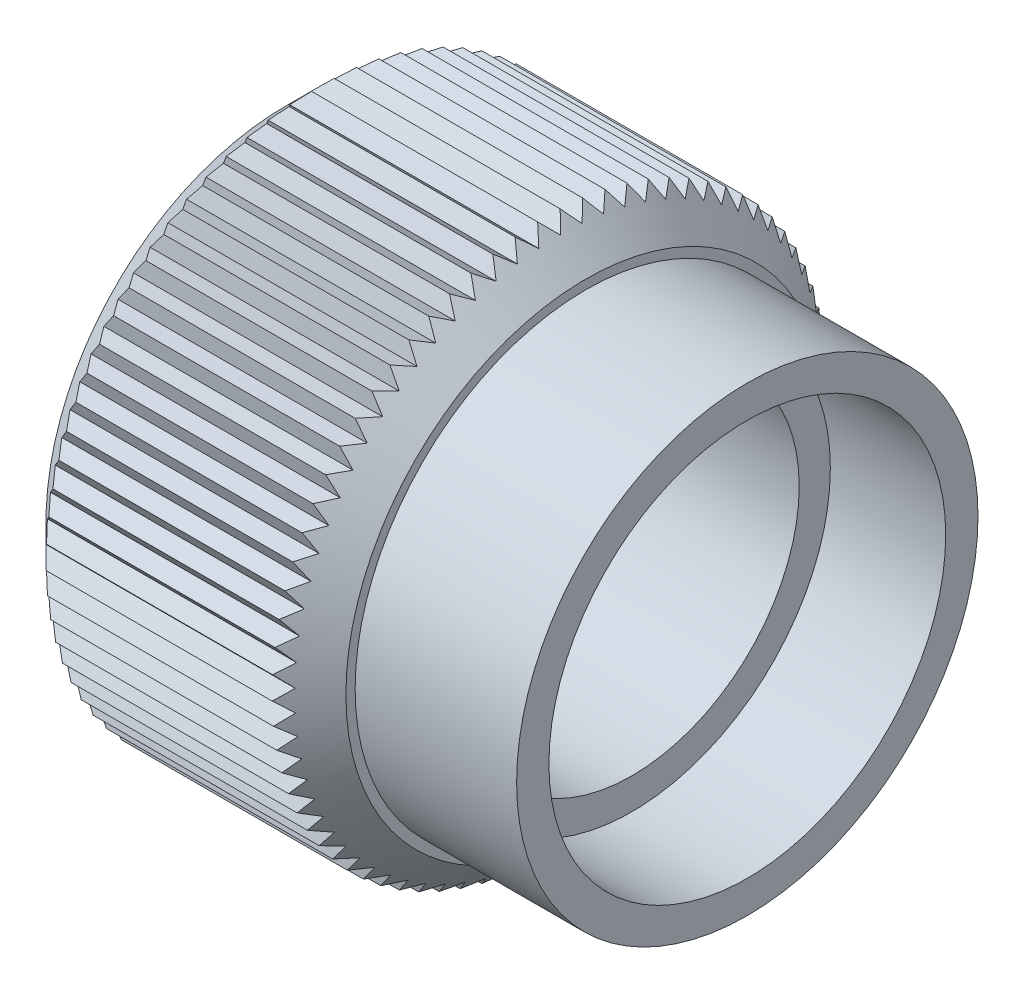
SolidWorks part; units mm, degrees
ref_plane "Vorne" through (0, 0, 0) normal (0, 0, 1) x (1, 0, 0)
ref_plane "Oben" through (0, 0, 0) normal (0, 1, 0) x (1, 0, 0)
ref_plane "Rechts" through (0, 0, 0) normal (1, 0, 0) x (0, 0, -1)
sketch "Skizze1" plane through (0, 0, 0) normal (0, 0, 1) x (1, 0, 0)
  line L0 (0, 0) -> (37.373, 0) construction
  line L1 (0, 6) -> (6.5, 6)
  line L2 (6.5, 6) -> (6.5, 5)
  line L3 (6.5, 5) -> (10, 5)
  line L4 (10, 5) -> (10, 4.3)
  line L5 (10, 4.3) -> (7.5, 4.3)
  line L6 (7.5, 4.3) -> (7.5, 3.5)
  line L7 (7.5, 3.5) -> (4, 3.5)
  line L8 (4, 3.5) -> (4, 5)
  line L9 (4, 5) -> (0, 5)
  line L10 (0, 5) -> (0, 6)
  dimension "D1" = 2.5
  dimension "D2" = 4
  dimension "D3" = 10
  dimension "D4" = 8.6
  dimension "D5" = 7
  dimension "D6" = 10
  dimension "D7" = 10
  dimension "D8" = 12
  dimension "D9" = 3.5
revolve "Rotation1" add sketch "Skizze1" angle 360 about L0
hole_wizard "M8x0.75 Gewindebohrung1" positions "Skizze3" profile "Skizze2" tap size "M8x1.0" standard "ISO"
sketch "Skizze3" plane through (7.5, 0, 0) normal (1, 0, 0) x (0, 0, -1)
  point P0 (0, 0)
sketch "Skizze2" plane through (7.5, 0, 0) normal (0, 1, 0) x (0, 0, -1)
  line L0 (0, 0) -> (0, 7.5)
  line L1 (0, 7.5) -> (3.625, 7.5)
  line L2 (3.625, 7.5) -> (3.625, 0)
  line L5 (3.625, 0) -> (0, 0)
  line L11 (0, -6.35) -> (0, 107.95) construction
  dimension "Bohrerdurchmesser" = 7.25
  dimension "Bohrungstiefe" = 7.5
chamfer "Fase1" distance 0.8 angle 45 2 edges at (6.5, 0, 6) (0, 0, 6)
sketch "Skizze4" plane through (0, 0, 0) normal (1, 0, 0) x (0, 0, -1)
  line L0 (-0.245, 5.995) -> (0, 5.75)
  line L1 (0, 5.75) -> (0.245, 5.995)
  line L2 (0, 0) -> (0, 5.75) construction
  circle A0 centre (0, 0) radius 6 construction
  arc A1 (0.245, 5.995) -> (-0.245, 5.995) centre (0, 0) ccw
  circle A2 centre (0, 0) radius 5.75 construction
  dimension "D2" = 11.5
  dimension "D1" = 90
extrude "Schnitt-Linear austragen1" cut sketch "Skizze4" along normal through all
pattern_circular "Kreismuster1" count 77 over 360 about axis through (0, 0, 0) along (1, 0, 0) of "Schnitt-Linear austragen1"
